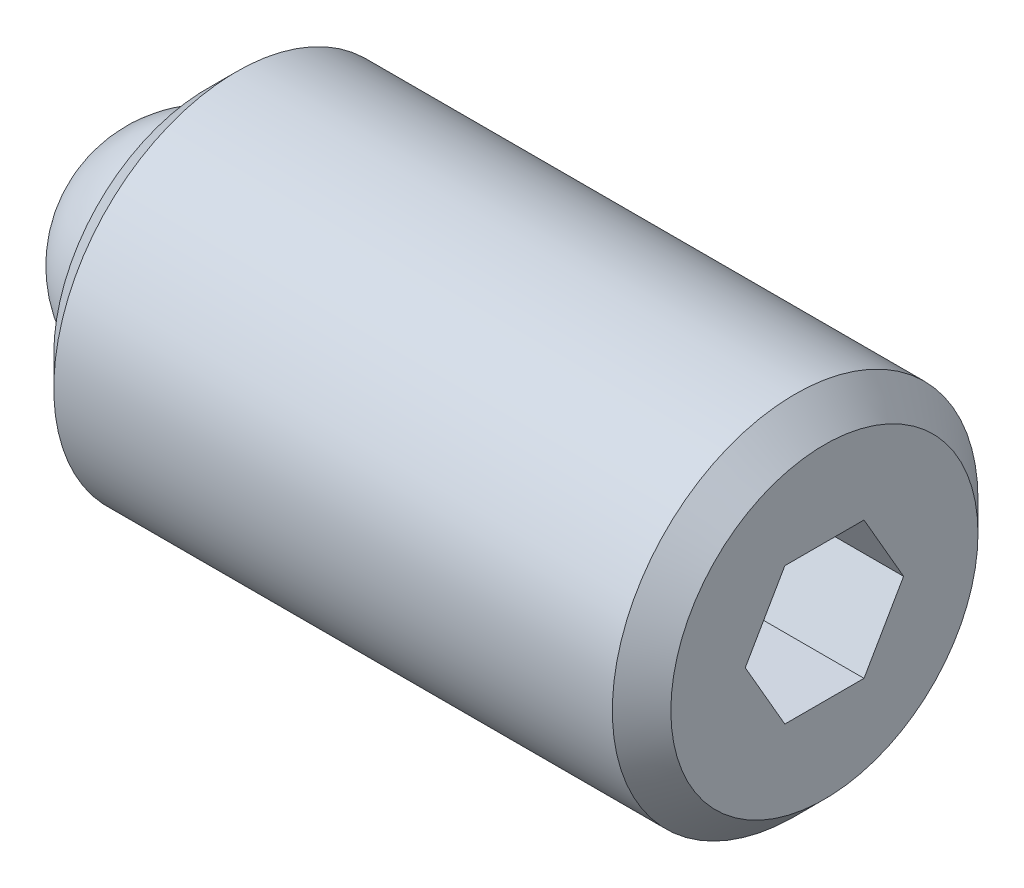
SolidWorks part; units mm, degrees
ref_plane "Front Plane" through (0, 0, 0) normal (0, 0, 1) x (1, 0, 0)
ref_plane "Top Plane" through (0, 0, 0) normal (0, 1, 0) x (1, 0, 0)
ref_plane "Right Plane" through (0, 0, 0) normal (1, 0, 0) x (0, 0, -1)
sketch "Sketch2" plane through (0, 0, 0) normal (1, 0, 0) x (0, 0, -1)
  circle A0 centre (0, 0) radius 3.175
  dimension "D1" = 6.35
extrude "Boss-Extrude1" add sketch "Sketch2" along normal blind 10.7156
sketch "Sketch3" plane through (0, 0, 0) normal (-1, 0, 0) x (0, 0, 1)
  circle A0 centre (0, 0) radius 1.9812
  dimension "D1" = 3.9624
chamfer "Chamfer1" distance 0.508 angle 45 1 edges at (0, 0, -3.175)
chamfer "Chamfer2" distance 0.508 angle 45 1 edges at (10.7156, 0, -3.175)
sketch "Sketch4" plane through (10.7156, 0, 0) normal (1, 0, 0) x (0, 0, -1)
  line L1 (1.3748, 0) -> (0.6874, 1.1906)
  line L2 (0.6874, 1.1906) -> (-0.6874, 1.1906)
  line L3 (-0.6874, 1.1906) -> (-1.3748, 0)
  line L4 (-1.3748, 0) -> (-0.6874, -1.1906)
  line L5 (-0.6874, -1.1906) -> (0.6874, -1.1906)
  line L6 (0.6874, -1.1906) -> (1.3748, 0)
  circle A0 centre (0, 0) radius 1.1906 construction
  dimension "D1" = 2.3813
extrude "Cut-Extrude2" cut sketch "Sketch4" against normal blind 2.286
extrude "Cut-Extrude3" cut sketch "Sketch3" against normal blind 1.9844
sketch "Sketch5" plane through (0, 0, 0) normal (-1, 0, 0) x (0, 0, 1)
  line L0 (0, 0) -> (0, -1.9844)
  line L1 (0, 0) -> (0, 1.9844)
  arc A0 (0, 1.9844) -> (0, -1.9844) centre (0, 0) ccw
  dimension "D1" = 1.9844
revolve "Revolve1" add sketch "Sketch5" angle 360 about L1
